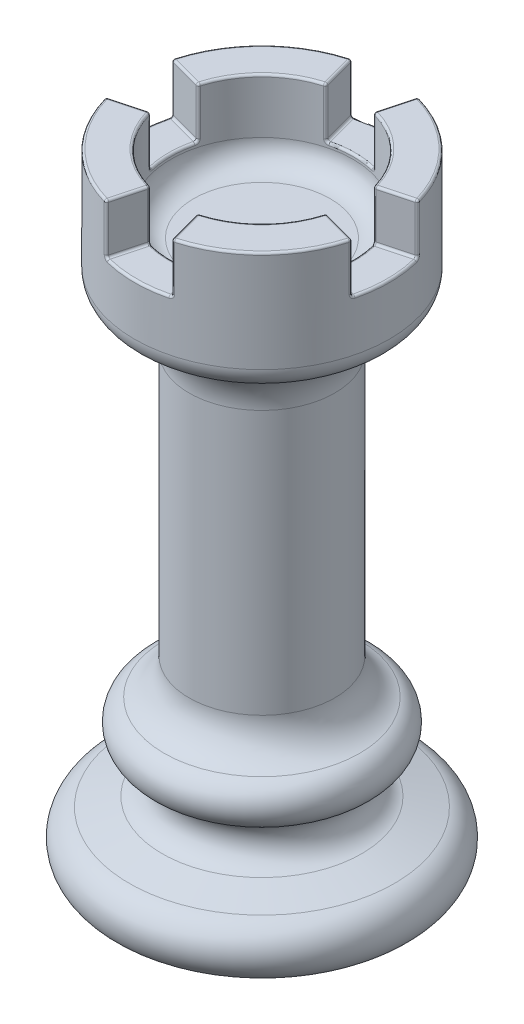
SolidWorks part; units mm, degrees
ref_plane "Front" through (0, 0, 0) normal (0, 0, 1) x (1, 0, 0)
ref_plane "Top" through (0, 0, 0) normal (0, 1, 0) x (1, 0, 0)
ref_plane "Right" through (0, 0, 0) normal (1, 0, 0) x (0, 0, -1)
sketch "Sketch1" plane through (0, 0, 0) normal (0, 0, 1) x (1, 0, 0)
  line L0 (0, 0) -> (0, 72.0534) construction
  line L1 (0, 0) -> (13.97, 0)
  line L2 (14.8003, 5.9807) -> (11.1344, 7.0186)
  line L3 (8.128, 20.575) -> (8.128, 50.039)
  line L4 (14.224, 58.293) -> (14.224, 69.596)
  line L5 (14.224, 69.596) -> (10.16, 69.596)
  line L6 (0, 60.96) -> (0, 0)
  line L7 (10.16, 69.596) -> (10.16, 63.5)
  line L8 (7.62, 60.96) -> (0, 60.96)
  arc A0 (13.97, 0) -> (14.8003, 5.9807) centre (13.97, 3.048) ccw
  arc A1 (11.1344, 7.0186) -> (10.941, 11.8433) centre (11.8263, 9.4625) cw
  arc A2 (10.941, 11.8433) -> (10.914, 16.6146) centre (10.0557, 14.224) ccw
  arc A3 (10.914, 16.6146) -> (8.128, 20.575) centre (12.3359, 20.575) cw
  arc A4 (8.128, 50.039) -> (12.4311, 55.8653) centre (14.224, 50.039) cw
  arc A5 (7.62, 60.96) -> (10.16, 63.5) centre (7.62, 63.5) ccw
  arc A6 (14.224, 58.293) -> (12.4311, 55.8653) centre (11.684, 58.293) cw
  dimension "D2" = 3.048
  dimension "D4" = 2.54
  dimension "D5" = 2.54
  dimension "D7" = 8.128
  dimension "D8" = 4.064
  dimension "D9" = 8.636
  dimension "D11" = 6.096
  dimension "D12" = 14.224
  dimension "D13" = 29.464
  dimension "D14" = 13.97
  dimension "D15" = 11.8263
  dimension "D16" = 4.2079
  dimension "D3" = 3.81
  dimension "D6" = 60.96
  dimension "D10" = 14.224
revolve "Base-Revolve" add sketch "Sketch1" angle 360 about L0
sketch "Sketch2" plane through (0, 69.596, 0) normal (0, 1, 0) x (-1, 0, 0)
  line L0 (-9.8138, -2.6296) -> (-13.7393, -3.6814)
  line L1 (0, 0) -> (-18.558, 0) construction
  line L2 (-9.8138, 2.6296) -> (-13.7393, 3.6814)
  circle A0 centre (0, 0) radius 10.16 construction
  circle A1 centre (0, 0) radius 14.224
  arc A2 (-13.7393, 3.6814) -> (-13.7393, -3.6814) centre (0, 0) ccw
  arc A3 (-9.8138, 2.6296) -> (-9.8138, -2.6296) centre (0, 0) ccw
  dimension "D2" = 15
  dimension "D1" = 0
extrude "Cut-Extrude1" cut sketch "Sketch2" against normal blind 5.588
pattern_circular "CirPattern1" count 4 over 360 about axis through (0, 0, 0) along (0, 1, 0) of "Cut-Extrude1"
fillet "Fillet3" radius 0.254 48 edges at (3.6814, 66.802, 13.7393) (-3.6814, 66.802, 13.7393) (13.7393, 66.802, -3.6814) (13.7393, 66.802, 3.6814) (-3.6814, 66.802, -13.7393) (3.6814, 66.802, -13.7393) (-13.7393, 66.802, 3.6814) (-13.7393, 66.802, -3.6814) (3.1555, 64.008, 11.7766) (0, 64.008, 14.224) (-3.1555, 64.008, 11.7766) (7.1842, 69.596, 7.1842) (11.7766, 69.596, 3.1555) (10.0579, 69.596, 10.0579) (3.1555, 69.596, 11.7766) (11.7766, 64.008, -3.1555) (14.224, 64.008, 0) (11.7766, 64.008, 3.1555) (10.0579, 69.596, -10.0579) (11.7766, 69.596, -3.1555) (7.1842, 69.596, -7.1842) (3.1555, 69.596, -11.7766) (-3.1555, 64.008, -11.7766) (0, 64.008, -14.224) (3.1555, 64.008, -11.7766) (-10.0579, 69.596, -10.0579) (-3.1555, 69.596, -11.7766) (-7.1842, 69.596, -7.1842) (-11.7766, 69.596, -3.1555) (-10.0579, 69.596, 10.0579) (-11.7766, 69.596, 3.1555) (-7.1842, 69.596, 7.1842) (-3.1555, 69.596, 11.7766) (-11.7766, 64.008, 3.1555) (-14.224, 64.008, 0) (-11.7766, 64.008, -3.1555) (2.6296, 66.802, 9.8138) (-2.6296, 66.802, 9.8138) (9.8138, 66.802, -2.6296) (9.8138, 66.802, 2.6296) (-2.6296, 66.802, -9.8138) (2.6296, 66.802, -9.8138) (-9.8138, 66.802, 2.6296) (-9.8138, 66.802, -2.6296) (0, 64.008, 10.16) (10.16, 64.008, 0) (0, 64.008, -10.16) (-10.16, 64.008, 0)
